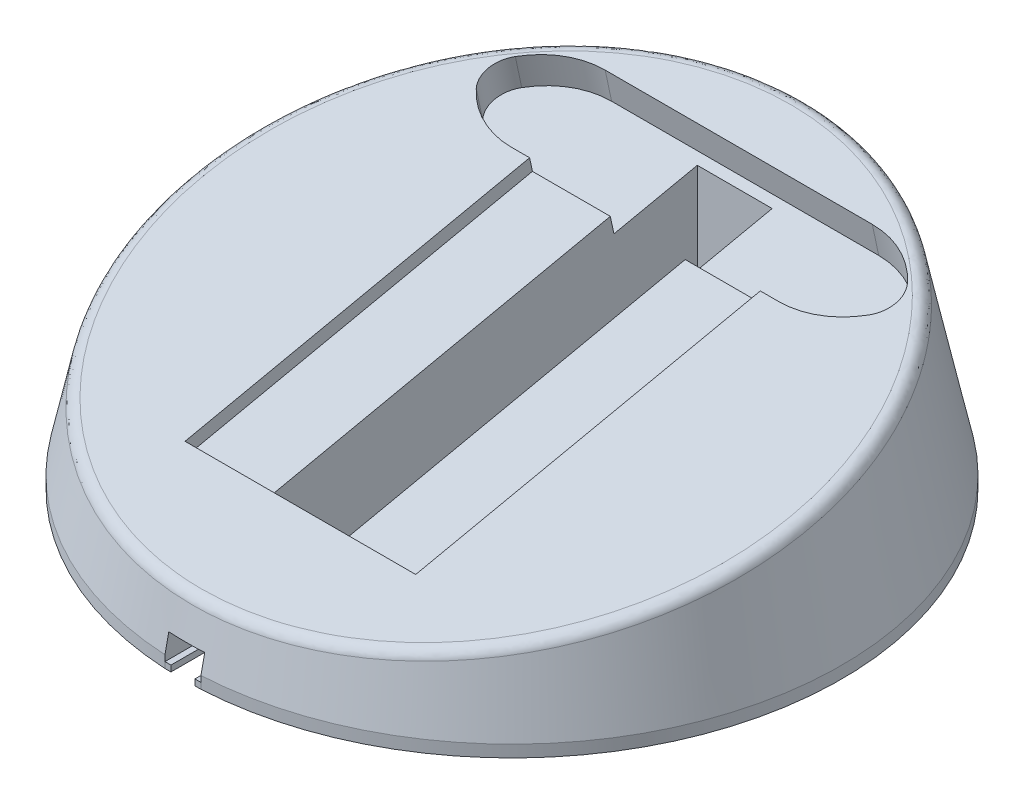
SolidWorks part; units mm, degrees
ref_plane "Front Plane" through (0, 0, 0) normal (0, 0, 1) x (1, 0, 0)
ref_plane "Top Plane" through (0, 0, 0) normal (0, 1, 0) x (1, 0, 0)
ref_plane "Right Plane" through (0, 0, 0) normal (1, 0, 0) x (0, 0, -1)
sketch "Sketch1" plane through (0, 0, 0) normal (0, 1, 0) x (1, 0, 0)
  circle A0 centre (0, 0) radius 55
  dimension "D1" = 110
extrude "Boss-Extrude1" add sketch "Sketch1" along normal blind 35 draft 12 contours A0
sketch "Sketch2" plane through (0, 0, 0) normal (1, 0, 0) x (0, 0, -1)
  line L0 (55.1122, 32.1433) -> (-53.0548, 9.1517)
  line L1 (-47.5605, 35) -> (-55, 0) construction
  line L2 (-53.0548, 9.1517) -> (-55, 0) construction
  line L4 (-32.8598, 13.4442) -> (-35.0701, 12.9744) construction
split "Split1" trim tools "Sketch2" bodies to split 101 resulting bodies 103
sketch "Sketch3" plane through (0, -1.317, -36) normal (1, 0, 0) x (0, 0, -1)
  line L0 (-27.9479, 93.0067) -> (-12.3484, 19.6167)
  line L1 (-12.3484, 19.6167) -> (15.519, 25.5401)
  line L2 (-13.8038, 26.4637) -> (-13.3879, 24.5075) construction
  line L3 (12.4679, 32.048) -> (-89.0548, 10.4687) construction
  dimension "D1" = 7
fillet "Fillet2" radius 2 1 edges at (0, 9.1517, 53.0548)
sketch "Sketch4" plane through (0, 0, 0) normal (0, -1, 0) x (1, 0, 0)
  circle A0 centre (0, 0) radius 55 construction
  circle A1 centre (0, 0) radius 55
extrude "Boss-Extrude2" add sketch "Sketch4" along normal blind 2
sketch "Sketch16" plane through (0, 0, 0) normal (0, 1, 0) x (1, 0, 0)
  line L0 (6, 36.9299) -> (0, 36.9299) construction
  line L27 (0, 37.1799) -> (0, -35.3201) construction
  line L33 (0, 37.1799) -> (-6.25, 37.1799)
  line L34 (6.25, 37.1799) -> (0, 37.1799)
  line L35 (6.25, -35.3201) -> (6.25, 37.1799)
  line L36 (0, -35.3201) -> (6.25, -35.3201)
  line L37 (-6.25, -35.3201) -> (0, -35.3201)
  line L38 (-6.25, 37.1799) -> (-6.25, -35.3201)
  dimension "D1" = 12.5
  dimension "D2" = 72.5
  dimension "D3" = 0.25
extrude "Cut-Extrude9" cut sketch "Sketch16" along normal through all both and the other way through all
sketch "Sketch17" plane through (0, 0, 0) normal (1, 0, 0) x (0, 0, -1)
  line L1 (-35.3201, 12.9213) -> (-35.3201, -2) construction
  line L2 (22.664, 22.9459) -> (22.1962, 25.1468)
  line L3 (-35.3201, 12.9213) -> (-35.3201, 10.621)
  line L4 (22.664, 22.9459) -> (-35.3201, 10.621)
  line L5 (22.1962, 25.1468) -> (-35.3201, 12.9213)
  line L7 (-35.3201, 12.9213) -> (37.1799, 28.3316) construction
  line L8 (9.7244, 83.822) -> (23.2358, 20.256) construction
  dimension "D1" = 2.25
extrude "Cut-Extrude10" cut sketch "Sketch17" against normal mid plane 38.5
sketch "Sketch50" plane through (0, 19.5457, 4.1546) normal (0, 0.9781, 0.2079) x (1, 0, 0)
  ellipse E0 centre (0, 34.9395) end of major axis (-3.925, 34.9395) minor radius 2.5625 construction
  ellipse E1 centre (0, 34.9395) end of major axis (-3.925, 34.9395) minor radius 2.5625
sketch "Sketch49" plane through (0, 19.5457, 4.1546) normal (0, 0.9781, 0.2079) x (1, 0, 0)
  line L0 (0, 0) -> (0, 94.9132) construction
  line L1 (-22.2918, 26.9395) -> (22.2918, 26.9395)
  line L3 (-22.2918, 42.9395) -> (22.2918, 42.9395)
  line L6 (0, 34.9395) -> (-34, 34.9395) construction
  line L7 (6.25, 26.9395) -> (19.25, 26.9395) construction
  arc A0 (-22.2918, 26.9395) -> (-32.7268, 31.6062) centre (-22.2918, 40.9395) cw
  arc A1 (-22.2918, 42.9395) -> (-32.7268, 38.2728) centre (-22.2918, 28.9395) ccw
  arc A2 (22.2918, 26.9395) -> (32.7268, 31.6062) centre (22.2918, 40.9395) ccw
  arc A3 (32.7268, 31.6062) -> (32.7268, 38.2728) centre (29, 34.9395) ccw
  arc A4 (-32.7268, 31.6062) -> (-32.7268, 38.2728) centre (-29, 34.9395) cw
  arc A5 (22.2918, 42.9395) -> (32.7268, 38.2728) centre (22.2918, 28.9395) cw
  point P25 (-9.6427, 34.9395)
  dimension "D2" = 58
  dimension "D1" = 5
  dimension "D3" = 14
extrude "Cut-Extrude11" cut sketch "Sketch49" against normal blind 5.15
ref_plane "Plane1" through (0, 0, -35.6799) normal (0, 0, 1) x (1, 0, 0)
sketch "Sketch70" plane through (0, 0, -35.6799) normal (0, 0, 1) x (1, 0, 0)
  line L0 (36.25, -2) -> (6.25, -2)
  line L2 (36.25, 14.5) -> (36.25, -2)
  line L3 (6.25, 23.0666) -> (6.25, -2) construction
  line L6 (6.25, -2) -> (-6.25, -2) construction
  line L9 (6.25, 14.5) -> (6.25, -2)
  line L11 (6.25, 14.5) -> (36.25, 14.5)
  dimension "D1" = 30
  dimension "D5" = 16.5
sketch "Sketch73" plane through (0, 0, 0) normal (1, 0, 0) x (0, 0, -1)
  line L0 (-35.3201, 8) -> (-37.3201, 8)
  line L1 (-35.3201, 10.621) -> (-35.3201, -2) construction
  line L2 (-35.3201, 8) -> (-35.3201, -2)
  line L3 (-35.3201, -2) -> (-55, -2)
  line L4 (-55, -2) -> (-55, 3)
  line L5 (-55, 3) -> (-50, 3)
  line L6 (-55, 0) -> (-55, -2) construction
  line L7 (-37.3201, 8) -> (-50, 3)
  dimension "D1" = 5
  dimension "D2" = 10
  dimension "D3" = 2
  dimension "D4" = 5
extrude "Cut-Extrude15" cut sketch "Sketch73" against normal mid plane 6
sketch "Sketch77" plane through (0, -2, 0) normal (0, -1, 0) x (1, 0, 0)
  line L0 (-15.7329, -43.2259) -> (0, 0) construction
  line L1 (0, 0) -> (0, -46) construction
  line L2 (0, 0) -> (-35.238, 29.5682) construction
  circle A0 centre (0, 0) radius 46 construction
  circle A1 centre (-15.7329, -43.2259) radius 6.6
  circle A3 centre (-35.238, 29.5682) radius 6.6
  dimension "D1" = 13.2
  dimension "D2" = 92
  dimension "D3" = 20
  dimension "D4" = 130
extrude "Cut-Extrude18" cut sketch "Sketch77" against normal blind 2.5
sketch "Sketch79" plane through (0, -2, 0) normal (0, -1, 0) x (1, 0, 0)
  line L1 (-3, 54.9181) -> (-2, 54.9181)
  line L2 (-3, 54.9181) -> (-3, 43.9181)
  line L3 (-3, 43.9181) -> (-2, 44.9181)
  line L4 (-2, 54.9181) -> (-2, 44.9181)
  dimension "D1" = 10
  dimension "D2" = 1
  dimension "D3" = 45
extrude "Boss-Extrude4" add sketch "Sketch79" against normal blind 1
mirror "Mirror2" about plane through (0, 0, 0) normal (1, 0, 0) of "Cut-Extrude18"
mirror "Mirror3" about plane through (0, 0, 0) normal (1, 0, 0) of "Boss-Extrude4"
fillet "Fillet4" radius 1 4 edges at (-2, -1.5, 44.9181) (-3, -1.5, 43.9181) (2, -1.5, 44.9181) (3, -1.5, 43.9181)
sketch "Sketch80" plane through (0, -2, 0) normal (0, -1, 0) x (1, 0, 0)
  line L1 (-2, 54.9181) -> (2, 54.9181)
  line L2 (-2, 54.9181) -> (-2, 46.9181)
  line L3 (-2, 46.9181) -> (2, 46.9181)
  line L4 (2, 54.9181) -> (2, 46.9181)
  line L5 (3, 43.5039) -> (3, 35.3201) construction
  line L6 (-3, 35.3201) -> (3, 35.3201)
  line L7 (-3, 35.3201) -> (-3, 43.3201)
  line L8 (-3, 43.3201) -> (3, 43.3201)
  line L9 (3, 35.3201) -> (3, 43.3201)
  line L10 (2, 45.3323) -> (2, 54.9181) construction
  dimension "D1" = 8
  dimension "D2" = 8
extrude "Cut after print" [suppressed] add sketch "Sketch80" against normal blind 0.25
